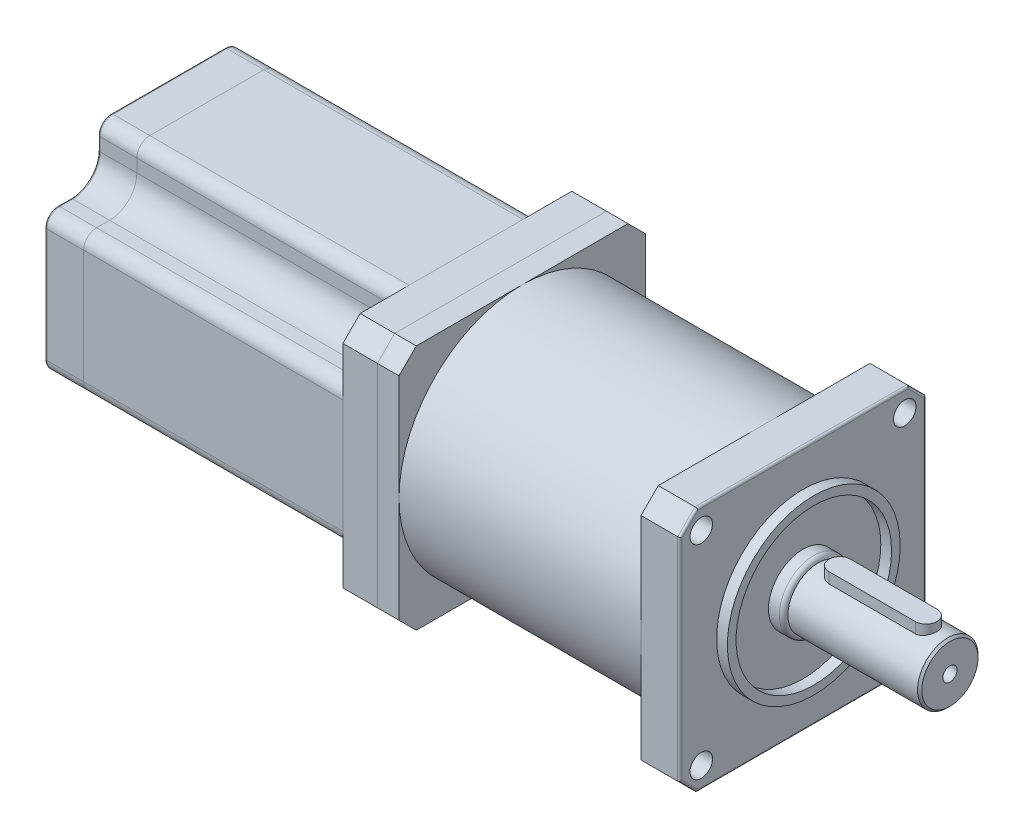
SolidWorks part; units mm, degrees
ref_plane "前视基准面" through (0, 0, 0) normal (0, 0, 1) x (1, 0, 0)
ref_plane "上视基准面" through (0, 0, 0) normal (0, 1, 0) x (1, 0, 0)
ref_plane "右视基准面" through (0, 0, 0) normal (1, 0, 0) x (0, 0, -1)
sketch "草图1" plane through (0, 0, 0) normal (1, 0, 0) x (0, 0, -1)
  line L0 (-28.5, 24.5) -> (-24.5, 28.5)
  line L1 (-24.5, -28.5) -> (24.5, -28.5)
  line L2 (-28.5, -24.5) -> (-28.5, 24.5)
  line L3 (-24.5, 28.5) -> (24.5, 28.5)
  line L4 (28.5, -24.5) -> (28.5, 24.5)
  line L5 (-28.5, -28.5) -> (28.5, 28.5) construction
  line L6 (-28.5, 28.5) -> (28.5, -28.5) construction
  line L7 (24.5, 28.5) -> (28.5, 24.5)
  line L8 (24.5, -28.5) -> (28.5, -24.5)
  line L9 (-28.5, -24.5) -> (-24.5, -28.5)
  point P0 (0, 0)
extrude "凸台-拉伸1" add sketch "草图1" against normal blind 9
sketch "草图2" plane through (-9, 0, 0) normal (-1, 0, 0) x (0, 0, 1)
  circle A0 centre (0, 0) radius 28.5
extrude "凸台-拉伸2" add sketch "草图2" along normal blind 56
sketch "草图3" plane through (-65, 0, 0) normal (-1, 0, 0) x (0, 0, 1)
  line L0 (0, 28.5) -> (24.5, 28.5) construction
  line L1 (-24.5, -28.5) -> (24.5, -28.5)
  line L2 (-28.5, -24.5) -> (-28.5, 24.5)
  line L3 (-24.5, 28.5) -> (24.5, 28.5)
  line L4 (28.5, -24.5) -> (28.5, 24.5)
  line L5 (-28.5, -28.5) -> (28.5, 28.5) construction
  line L6 (-28.5, 28.5) -> (28.5, -28.5) construction
  line L7 (-28.5, 24.5) -> (-24.5, 28.5)
  line L8 (24.5, 28.5) -> (28.5, 24.5)
  line L9 (24.5, -28.5) -> (28.5, -24.5)
  line L10 (-28.5, -24.5) -> (-24.5, -28.5)
  point P0 (0, 0)
extrude "凸台-拉伸3" add sketch "草图3" along normal blind 5
sketch "草图4" plane through (-70, 0, 0) normal (-1, 0, 0) x (0, 0, 1)
  line L0 (24.5, 28.5) -> (-24.5, 28.5) construction
  line L1 (-24.5, -28.5) -> (24.5, -28.5)
  line L2 (-28.5, -24.5) -> (-28.5, 24.5)
  line L3 (-24.5, 28.5) -> (24.5, 28.5)
  line L4 (28.5, -24.5) -> (28.5, 24.5)
  line L5 (-28.5, -28.5) -> (28.5, 28.5) construction
  line L6 (-28.5, 28.5) -> (28.5, -28.5) construction
  line L7 (-28.5, 24.5) -> (-24.5, 28.5)
  line L8 (24.5, 28.5) -> (28.5, 24.5)
  line L9 (24.5, -28.5) -> (28.5, -24.5)
  line L10 (-28.5, -24.5) -> (-24.5, -28.5)
  point P0 (0, 0)
extrude "凸台-拉伸4" add sketch "草图4" along normal blind 8 separate body
sketch "草图5" plane through (-78, 0, 0) normal (-1, 0, 0) x (0, 0, 1)
  line L0 (24.5, 28.5) -> (-24.5, 28.5) construction
  line L1 (-24.5, -28.5) -> (24.5, -28.5)
  line L2 (-28.5, -24.5) -> (-28.5, 24.5)
  line L3 (-24.5, 28.5) -> (24.5, 28.5)
  line L4 (28.5, -24.5) -> (28.5, 24.5)
  line L5 (-28.5, -28.5) -> (28.5, 28.5) construction
  line L6 (-28.5, 28.5) -> (28.5, -28.5) construction
  line L7 (-28.5, 24.5) -> (-24.5, 28.5)
  line L8 (-24.5, -28.5) -> (-28.5, -24.5)
  line L9 (24.5, -28.5) -> (28.5, -24.5)
  line L10 (28.5, 24.5) -> (24.5, 28.5)
  point P0 (0, 0)
extrude "凸台-拉伸5" add sketch "草图5" along normal blind 60 separate body
sketch "草图6" plane through (-138, 0, 0) normal (-1, 0, 0) x (0, 0, 1)
  line L0 (24.5, 28.5) -> (-24.5, 28.5) construction
  line L1 (-24.5, -28.5) -> (24.5, -28.5)
  line L2 (-28.5, -24.5) -> (-28.5, 24.5)
  line L3 (-24.5, 28.5) -> (24.5, 28.5)
  line L4 (28.5, -24.5) -> (28.5, 24.5)
  line L5 (-28.5, -28.5) -> (28.5, 28.5) construction
  line L6 (-28.5, 28.5) -> (28.5, -28.5) construction
  line L7 (-28.5, 24.5) -> (-24.5, 28.5)
  line L8 (-24.5, -28.5) -> (-28.5, -24.5)
  line L9 (24.5, -28.5) -> (28.5, -24.5)
  line L10 (28.5, 24.5) -> (24.5, 28.5)
  point P0 (0, 0)
extrude "凸台-拉伸6" add sketch "草图6" along normal blind 9 separate body
sketch "草图7" plane through (-147, 0, 0) normal (-1, 0, 0) x (0, 0, 1)
  line L0 (-22.5, 16.1754) -> (-25.5, 16.1754)
  line L1 (-28.5, 13.1754) -> (-28.5, 24.5)
  line L2 (-28.5, 24.5) -> (-24.5, 28.5)
  line L3 (-24.5, 28.5) -> (-13.1754, 28.5)
  line L4 (13.1754, 28.5) -> (24.5, 28.5)
  line L5 (24.5, 28.5) -> (28.5, 24.5)
  line L6 (28.5, 24.5) -> (28.5, 13.1754)
  line L7 (-28.5, 24.5) -> (-28.5, -24.5) construction
  line L9 (-25.5, -16.1754) -> (-22.5, -16.1754)
  line L10 (28.5, -13.1754) -> (28.5, -24.5)
  line L11 (-16.1754, -22.5) -> (-16.1754, -25.5)
  line L12 (-24.5, -28.5) -> (24.5, -28.5) construction
  line L14 (16.1754, -25.5) -> (16.1754, -22.5)
  line L15 (28.5, -24.5) -> (24.5, -28.5)
  line L16 (22.5, -16.1754) -> (25.5, -16.1754)
  line L17 (28.5, -24.5) -> (28.5, 24.5) construction
  line L19 (25.5, 16.1754) -> (22.5, 16.1754)
  line L20 (24.5, -28.5) -> (13.1754, -28.5)
  line L21 (16.1754, 22.5) -> (16.1754, 25.5)
  line L22 (24.5, 28.5) -> (-24.5, 28.5) construction
  line L24 (-16.1754, 25.5) -> (-16.1754, 22.5)
  line L25 (-13.1754, -28.5) -> (-24.5, -28.5)
  line L26 (-24.5, -28.5) -> (-28.5, -24.5)
  line L27 (-28.5, -24.5) -> (-28.5, -13.1754)
  arc A0 (-22.5, 16.1754) -> (-16.1754, 22.5) centre (-22.5, 22.5) ccw
  arc A1 (16.1754, 22.5) -> (22.5, 16.1754) centre (22.5, 22.5) ccw
  arc A2 (22.5, -16.1754) -> (16.1754, -22.5) centre (22.5, -22.5) ccw
  arc A3 (-16.1754, -22.5) -> (-22.5, -16.1754) centre (-22.5, -22.5) ccw
  arc A4 (-13.1754, 28.5) -> (-16.1754, 25.5) centre (-13.1754, 25.5) ccw
  arc A5 (16.1754, 25.5) -> (13.1754, 28.5) centre (13.1754, 25.5) ccw
  arc A6 (28.5, 13.1754) -> (25.5, 16.1754) centre (25.5, 13.1754) ccw
  arc A7 (25.5, -16.1754) -> (28.5, -13.1754) centre (25.5, -13.1754) ccw
  arc A8 (13.1754, -28.5) -> (16.1754, -25.5) centre (13.1754, -25.5) ccw
  arc A9 (-16.1754, -25.5) -> (-13.1754, -28.5) centre (-13.1754, -25.5) ccw
  arc A10 (-28.5, -13.1754) -> (-25.5, -16.1754) centre (-25.5, -13.1754) ccw
  arc A11 (-25.5, 16.1754) -> (-28.5, 13.1754) centre (-25.5, 13.1754) ccw
  point P0 (0, 0)
  point P10 (-16.1754, 28.5)
  point P39 (16.1754, 28.5)
  point P42 (28.5, 16.1754)
  point P45 (28.5, -16.1754)
  point P48 (16.1754, -28.5)
  point P51 (-16.1754, -28.5)
  point P54 (-28.5, -16.1754)
  point P57 (-28.5, 16.1754)
  dimension "D1" = 3
extrude "切除-拉伸1" cut sketch "草图7" against normal blind 69
fillet "圆角1" radius 0.5 24 edges at (-147, 28.5, 0) (-147, 27.6213, 15.2968) (-147, 24, 16.1754) (-147, 18.0279, 18.0279) (-147, 16.1754, 24) (-147, 15.2968, 27.6213) (-147, 0, 28.5) (-147, -15.2968, 27.6213) (-147, -16.1754, 24) (-147, -18.0279, 18.0279) (-147, -24, 16.1754) (-147, -27.6213, 15.2968) (-147, -28.5, 0) (-147, -27.6213, -15.2968) (-147, -24, -16.1754) (-147, -18.0279, -18.0279) (-147, -16.1754, -24) (-147, -15.2968, -27.6213) (-147, 0, -28.5) (-147, 15.2968, -27.6213) (-147, 16.1754, -24) (-147, 18.0279, -18.0279) (-147, 24, -16.1754) (-147, 27.6213, -15.2968)
fillet "圆角2" radius 0.5 8 edges at (0, 26.5, -26.5) (0, 0, -28.5) (0, -26.5, -26.5) (0, -28.5, 0) (0, -26.5, 26.5) (0, 0, 28.5) (0, 26.5, 26.5) (0, 28.5, 0)
sketch "草图8" plane through (0, 0, 0) normal (1, 0, 0) x (0, 0, -1)
  circle A0 centre (-23.55, 23.55) radius 2.6
  circle A1 centre (23.55, 23.55) radius 2.6
  circle A2 centre (23.55, -23.55) radius 2.6
  circle A3 centre (-23.55, -23.55) radius 2.6
  point P0 (0, 0)
extrude "切除-拉伸2" cut sketch "草图8" against normal blind 9
sketch "草图9" plane through (0, 0, 0) normal (1, 0, 0) x (0, 0, -1)
  circle A0 centre (0, 0) radius 20
  circle A1 centre (0, 0) radius 18
extrude "凸台-拉伸7" add sketch "草图9" along normal blind 2.5
sketch "草图10" plane through (0, 0, 0) normal (1, 0, 0) x (0, 0, -1)
  circle A0 centre (0, 0) radius 8
extrude "凸台-拉伸8" add sketch "草图10" along normal blind 3.5
fillet "圆角3" radius 1 1 edges at (3.5, 0, -8)
sketch "草图11" plane through (3.5, 0, 0) normal (1, 0, 0) x (0, 0, -1)
  circle A0 centre (0, 0) radius 7
extrude "凸台-拉伸9" add sketch "草图11" along normal blind 30.5 separate body
ref_plane "基准面1" through (0, 7, 0) normal (0, 1, 0) x (1, 0, 0)
sketch "草图12" plane through (0, 7, 0) normal (0, 1, 0) x (1, 0, 0)
  line L4 (8.5, 2.5) -> (28.5, 2.5)
  line L6 (28.5, -2.5) -> (8.5, -2.5)
  arc A0 (28.5, -2.5) -> (28.5, 2.5) centre (28.5, 0) ccw
  arc A1 (8.5, 2.5) -> (8.5, -2.5) centre (8.5, 0) ccw
extrude "切除-拉伸3" cut sketch "草图12" against normal blind 3
sketch "草图13" plane through (0, 4, 0) normal (0, 1, 0) x (1, 0, 0)
  line L0 (28.5, 2.5) -> (8.5, 2.5)
  line L2 (8.5, -2.5) -> (28.5, -2.5)
  arc A0 (8.5, 2.5) -> (8.5, -2.5) centre (8.5, 0) ccw
  arc A1 (28.5, -2.5) -> (28.5, 2.5) centre (28.5, 0) ccw
extrude "凸台-拉伸10" add sketch "草图13" along normal blind 5 separate body
chamfer "倒角1" distance 0.5 angle 45 1 edges at (34, 0, -7)
sketch "草图14" plane through (34, 0, 0) normal (1, 0, 0) x (0, 0, -1)
  point P0 (0, 0)
hole_wizard "M4 螺纹孔1" positions "3D草图3" profile "草图16" tap size "M4" standard "GB"
sketch3d "3D草图3"
  point P0 (34, 0, 0)
sketch "草图16" plane through (34, 0, 0) normal (0, 1, 0) x (0, 0, -1)
  line L0 (0, 0) -> (0, 10.4914)
  line L1 (0, 10.4914) -> (1.65, 9.5)
  line L2 (1.65, 9.5) -> (1.65, 0)
  line L5 (1.65, 0) -> (0, 0)
  line L10 (0, 10.4914) -> (-1.65, 9.5) construction
  line L11 (0, -6.35) -> (0, 107.95) construction
  dimension "螺纹孔钻头直径" = 3.3
  dimension "螺纹孔钻头深度" = 9.5
  dimension "导头角度" = 118
